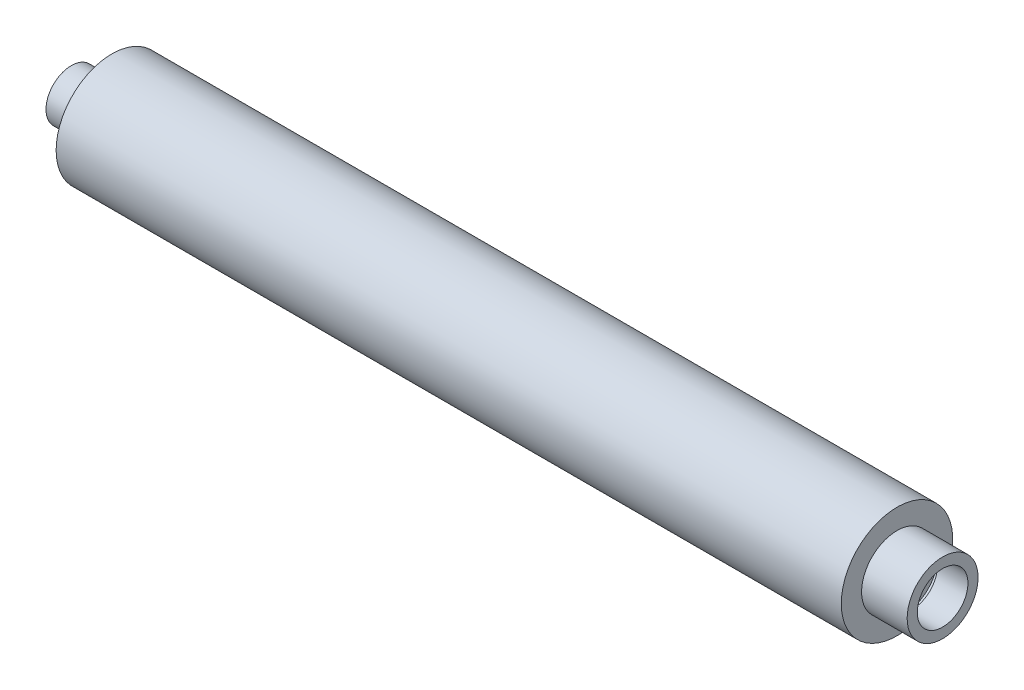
SolidWorks part; units mm, degrees
ref_plane "Plan1" through (0, 0, 0) normal (0, 0, 1) x (1, 0, 0)
ref_plane "Plan2" through (0, 0, 0) normal (0, 1, 0) x (1, 0, 0)
ref_plane "Plan3" through (0, 0, 0) normal (1, 0, 0) x (0, 0, -1)
sketch "Esquisse1" plane through (0, 0, 0) normal (0, 0, 1) x (1, 0, 0)
  line L0 (-50, 0) -> (78, 0) construction
  line L1 (-38, 0) -> (-38, 5)
  line L2 (-38, 5) -> (-30, 5)
  line L3 (-30, 5) -> (-30, 11)
  line L4 (-30, 11) -> (125, 11)
  line L5 (125, 11) -> (125, 7)
  line L6 (125, 7) -> (134, 7)
  line L7 (134, 7) -> (134, 5)
  line L8 (134, 5) -> (128, 5)
  line L9 (124, 5) -> (124, 10)
  line L10 (124, 10) -> (-29, 10)
  line L11 (-29, 10) -> (-29, 0)
  line L12 (-38, 0) -> (-29, 0)
  line L13 (128, 5) -> (128, 6.5)
  line L14 (128, 6.5) -> (126.5, 6.5)
  line L15 (126.5, 6.5) -> (126.5, 5)
  line L16 (126.5, 5) -> (124, 5)
  dimension "D1" = 5
  dimension "D2" = 155
  dimension "D3" = 10
  dimension "D4" = 5
  dimension "D5" = 8
  dimension "D6" = 1
  dimension "D7" = 153
  dimension "D8" = 10
  dimension "D9" = 1.5
  dimension "D10" = 1.5
revolve "Base-Révolution" add sketch "Esquisse1" angle 360 about L0
